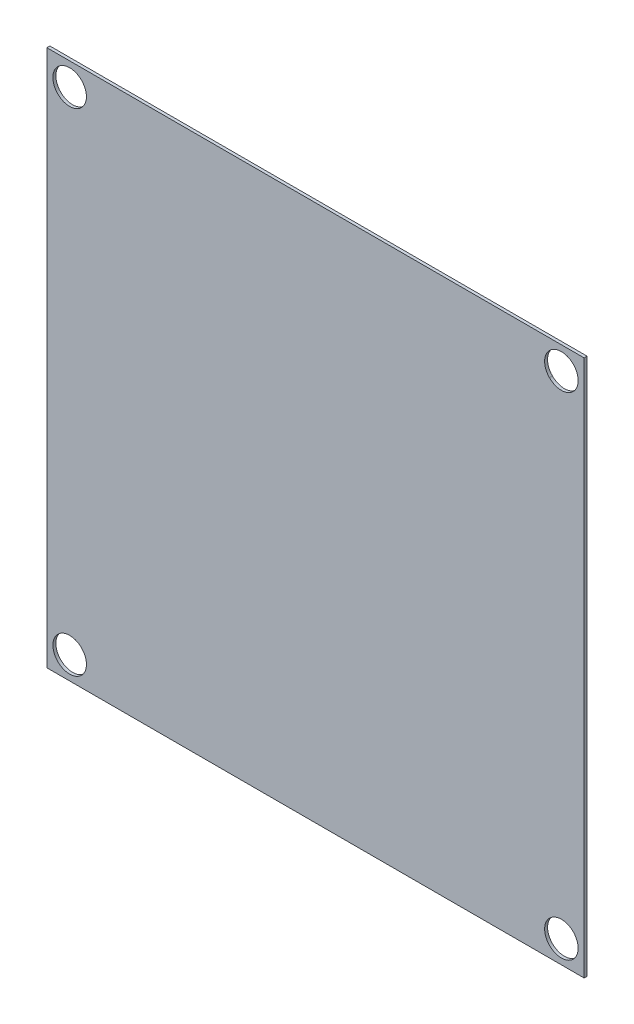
SolidWorks part; units mm, degrees
ref_plane "Front Plane" through (0, 0, 0) normal (0, 0, 1) x (1, 0, 0)
ref_plane "Top Plane" through (0, 0, 0) normal (0, 1, 0) x (1, 0, 0)
ref_plane "Right Plane" through (0, 0, 0) normal (1, 0, 0) x (0, 0, -1)
sketch "Sketch2" plane through (0, 0, 0) normal (0, 0, 1) x (1, 0, 0)
  line L0 (38.0639, 282.4571) -> (38.0639, 276.0916)
  line L1 (33.0487, 282.4571) -> (38.0639, 282.4571)
  line L2 (33.0487, 276.0916) -> (33.0487, 282.4571)
  line L3 (59.2819, 303.6751) -> (59.2819, 308.626)
  line L4 (65.6473, 303.6751) -> (59.2819, 303.6751)
  line L5 (65.6473, 308.626) -> (65.6473, 303.6751)
  line L6 (59.2819, 308.626) -> (65.6473, 308.626)
  line L7 (65.6473, 43.4648) -> (59.2819, 43.4648)
  line L8 (65.6473, 48.48) -> (65.6473, 43.4648)
  line L9 (59.2819, 48.48) -> (65.6473, 48.48)
  line L10 (59.2819, 43.4648) -> (59.2819, 48.48)
  line L11 (33.0487, 69.698) -> (33.0487, 76.0635)
  line L12 (38.0639, 69.698) -> (33.0487, 69.698)
  line L13 (38.0639, 76.0635) -> (38.0639, 69.698)
  line L14 (33.0487, 76.0635) -> (38.0639, 76.0635)
  line L15 (271.9766, 48.48) -> (271.9766, 43.4648)
  line L16 (265.6755, 48.48) -> (271.9766, 48.48)
  line L17 (265.6755, 43.4648) -> (265.6755, 48.48)
  line L18 (271.9766, 43.4648) -> (265.6755, 43.4648)
  line L19 (298.2099, 76.0635) -> (298.2099, 69.698)
  line L20 (293.1947, 76.0635) -> (298.2099, 76.0635)
  line L21 (293.1947, 69.698) -> (293.1947, 76.0635)
  line L22 (298.2099, 69.698) -> (293.1947, 69.698)
  line L23 (298.2099, 282.4571) -> (298.2099, 276.0916)
  line L24 (293.1947, 282.4571) -> (298.2099, 282.4571)
  line L25 (293.1947, 276.0916) -> (293.1947, 282.4571)
  line L26 (298.2099, 276.0916) -> (293.1947, 276.0916)
  line L27 (265.6755, 308.626) -> (271.9766, 308.626)
  line L28 (265.6755, 303.6751) -> (265.6755, 308.626)
  line L29 (271.9766, 303.6751) -> (265.6755, 303.6751)
  line L30 (271.9766, 308.626) -> (271.9766, 303.6751)
  line L95 (165.5605, 176.0234) -> (309.1739, 176.0776) construction
  line L96 (305.9777, 313.998) -> (305.9777, 299.9166)
  line L97 (284.7182, 316.3938) -> (305.0864, 316.3938)
  line L98 (297.4148, 303.6657) -> (297.4148, 305.1432)
  line L99 (23.1439, 33.6434) -> (307.977, 33.6434)
  line L100 (23.1439, 33.6434) -> (23.1439, 318.4034)
  line L101 (23.1439, 318.4034) -> (307.977, 318.4034)
  line L102 (307.977, 33.6434) -> (307.977, 318.4034)
  line L103 (23.1439, 33.6434) -> (307.977, 318.4034)
  line L104 (23.1439, 318.4034) -> (307.977, 33.6434) construction
  line L287 (309.1522, 326.0234) -> (315.5239, 326.0234)
  line L288 (315.5239, 181.0606) -> (309.1739, 181.0606)
  line L289 (315.5239, 326.0234) -> (315.5239, 181.0606)
  line L290 (309.1522, 326.0234) -> (309.1739, 319.6734)
  line L291 (309.1739, 181.0606) -> (309.1739, 319.6734)
  line L292 (309.1739, 171.0945) -> (315.5239, 171.0945)
  line L293 (309.1739, 32.3734) -> (309.1739, 171.0945)
  line L294 (309.1739, 32.3734) -> (309.1522, 26.0234)
  line L295 (309.1522, 26.0234) -> (315.5239, 26.0234)
  line L296 (315.5239, 171.0945) -> (315.5239, 26.0234)
  line L297 (315.5239, 171.0945) -> (315.5239, 181.0606)
  line L298 (309.1739, 171.0945) -> (309.1739, 181.0606)
  line L299 (170.6445, 319.6734) -> (170.6445, 326.0234)
  line L300 (309.1522, 326.0234) -> (170.6445, 326.0234)
  line L301 (309.1739, 319.6734) -> (170.6445, 319.6734)
  line L302 (170.6445, 326.0234) -> (160.4765, 326.0234)
  line L303 (160.4765, 319.6734) -> (170.6445, 319.6734)
  line L304 (160.4765, 326.0234) -> (160.4765, 319.6734)
  line L305 (160.4765, 319.6734) -> (21.8739, 319.7014)
  line L306 (21.8739, 319.7014) -> (21.8739, 326.0234)
  line L307 (160.4765, 326.0234) -> (21.8739, 326.0234)
  line L308 (21.8739, 326.0234) -> (15.5239, 326.0234)
  line L309 (15.5239, 171.11) -> (21.8739, 171.11)
  line L310 (21.8739, 171.11) -> (21.8739, 32.3888)
  line L311 (21.8739, 32.3888) -> (21.8522, 26.0234)
  line L312 (21.8522, 26.0234) -> (15.5239, 26.0234)
  line L313 (15.5239, 171.11) -> (15.5239, 26.0234)
  line L314 (15.5239, 171.1093) -> (15.5239, 171.11)
  line L315 (21.8739, 171.11) -> (21.8739, 171.1093)
  line L316 (21.8739, 171.1093) -> (15.5239, 171.1093)
  line L317 (15.5239, 326.0234) -> (15.5239, 171.1093)
  line L318 (21.8739, 319.7014) -> (21.8739, 171.1093)
  line L319 (165.5605, 32.3734) -> (160.433, 26.0234)
  line L321 (160.433, 26.0234) -> (21.8522, 26.0234)
  line L322 (160.433, 26.0234) -> (170.6445, 26.0234)
  line L323 (170.6445, 26.0234) -> (165.5605, 32.3734)
  line L324 (309.1522, 26.0234) -> (170.6445, 26.0234)
  line L325 (165.5605, 32.3734) -> (309.1739, 32.3734)
  line L326 (165.5605, 32.3734) -> (165.5605, 32.3734)
  line L327 (38.0639, 276.0916) -> (33.0487, 276.0916)
  line L328 (165.5605, 319.6734) -> (165.5605, 32.3734) construction
  circle A1 centre (296.4095, 306.8257) radius 9.5682
  circle A2 centre (34.7114, 306.8257) radius 9.5682
  circle A3 centre (296.5082, 45.3198) radius 9.5682
  circle A4 centre (34.8102, 45.1224) radius 9.5682
  circle A7 centre (297.4148, 304.4045) radius 0.7388
  point P53 (0, 0)
  dimension "D1" = 1.1969
  dimension "D2" = 300
  dimension "D3" = 6.35
  dimension "D4" = 6.35
  dimension "D5" = 6.35
  dimension "D6" = 6.35
  dimension "D7" = 300
  dimension "D8" = 1.27
  dimension "D9" = 1.27
  dimension "D10" = 1.27
  dimension "D11" = 6.35
  dimension "D12" = 6.35
  dimension "D13" = 2.0095
extrude "Boss-Extrude1" add sketch "Sketch2" along normal blind 1.5748 contours A1 | L100 L99 L102 L101
sketch "Sketch3" plane through (0, 0, 1.5748) normal (0, 0, 1) x (1, 0, 0)
  line L0 (307.977, 318.4034) -> (23.1439, 33.6434)
  line L1 (295.9234, 306.3528) -> (289.6364, 300.0675)
  line L4 (307.977, 318.4034) -> (23.1439, 318.4034)
  line L5 (23.1439, 318.4034) -> (23.1439, 33.6434)
  line L6 (23.1439, 33.6434) -> (307.977, 33.6434)
  line L7 (307.977, 33.6434) -> (307.977, 318.4034)
  line L8 (307.977, 318.4034) -> (23.1439, 318.4034)
  line L9 (23.1439, 318.4034) -> (23.1439, 33.6434)
  line L10 (23.1439, 33.6434) -> (307.977, 33.6434)
  line L11 (307.977, 33.6434) -> (307.977, 318.4034)
  circle A0 centre (295.9234, 306.3528) radius 8.89
  circle A1 centre (296.4095, 306.8257) radius 9.5682 construction
  dimension "D2" = 17.78
  dimension "D1" = 0
extrude "Boss-Extrude2" add sketch "Sketch3" against normal up to surface (1.5748 mm away) contours A0 L0 M7 | A0 L0 M7
sketch "Sketch4" plane through (0, 0, 1.5748) normal (0, 0, 1) x (1, 0, 0)
  line L0 (165.5605, 318.4034) -> (165.5605, 33.6434) construction
  line L1 (23.1439, 318.4034) -> (307.977, 318.4034) construction
  line L2 (23.1439, 33.6434) -> (307.977, 33.6434) construction
  line L3 (23.1439, 176.0234) -> (307.977, 176.0234)
  line L4 (307.977, 33.6434) -> (307.977, 318.4034) construction
  line L9 (307.977, 318.4034) -> (23.1439, 318.4034)
  line L10 (23.1439, 318.4034) -> (23.1439, 33.6434)
  line L11 (23.1439, 33.6434) -> (307.977, 33.6434)
  line L12 (307.977, 33.6434) -> (307.977, 318.4034)
  line L13 (307.977, 318.4034) -> (23.1439, 318.4034)
  line L14 (23.1439, 318.4034) -> (23.1439, 33.6434)
  line L15 (23.1439, 33.6434) -> (307.977, 33.6434)
  line L16 (307.977, 33.6434) -> (307.977, 318.4034)
  circle A0 centre (295.9234, 306.3528) radius 8.89
  arc A1 (289.6364, 300.0675) -> (289.5508, 300.1542) centre (295.9234, 306.3528) ccw construction
  circle A2 centre (35.1976, 306.3528) radius 8.89
  circle A3 centre (35.1976, 45.6939) radius 8.89
  circle A4 centre (295.9234, 45.6939) radius 8.89
  point P11 (165.5605, 176.0234)
  dimension "D2" = 17.78
  dimension "D1" = 0
extrude "Cut-Extrude1" cut sketch "Sketch4" against normal blind 1.5748 contours A2 | A3 | A4
